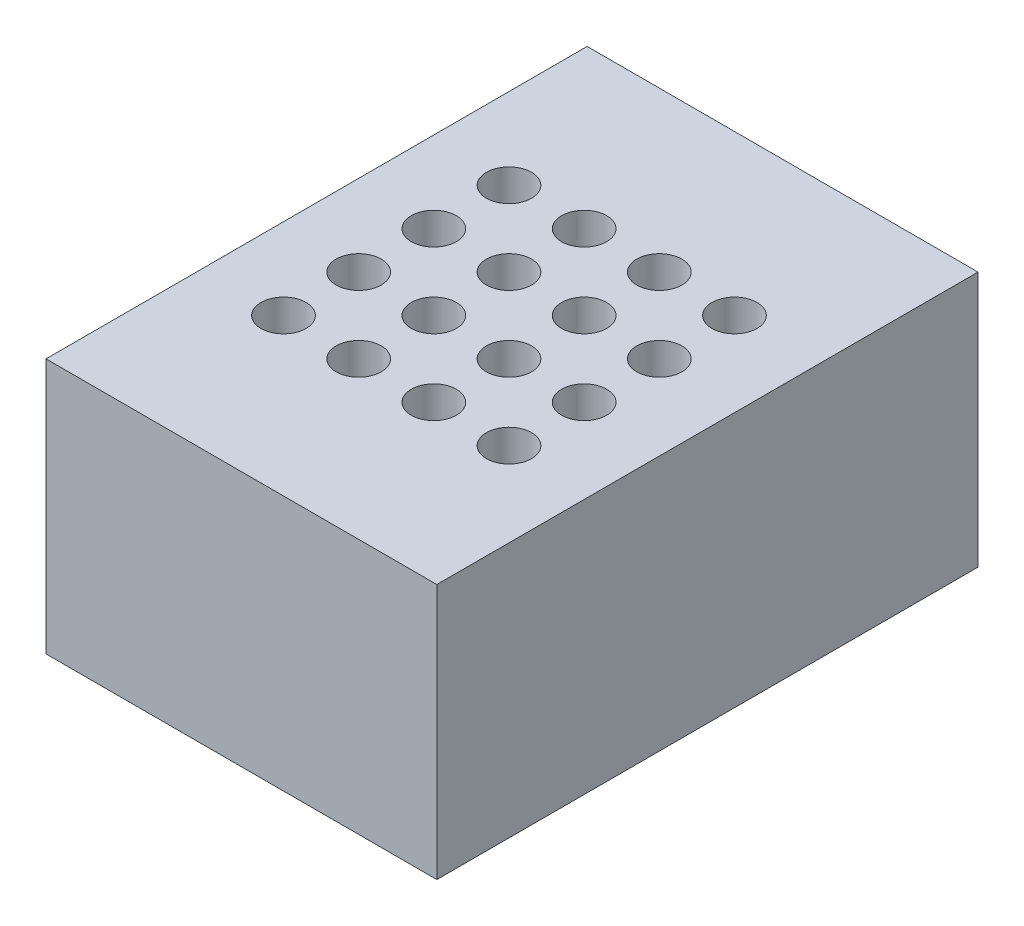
SolidWorks part; units mm, degrees
ref_plane "Front Plane" through (0, 0, 0) normal (0, 0, 1) x (1, 0, 0)
ref_plane "Top Plane" through (0, 0, 0) normal (0, 1, 0) x (1, 0, 0)
ref_plane "Right Plane" through (0, 0, 0) normal (1, 0, 0) x (0, 0, -1)
sketch "Sketch1" plane through (0, 0, 0) normal (0, 1, 0) x (1, 0, 0)
  line L1 (-5.835, -12.3052) -> (7.165, -12.3052)
  line L2 (-5.835, -12.3052) -> (-5.835, 5.6948)
  line L3 (-5.835, 5.6948) -> (7.165, 5.6948)
  line L4 (7.165, -12.3052) -> (7.165, 5.6948)
  dimension "D1" = 13
  dimension "D2" = 18
extrude "Boss-Extrude1" add sketch "Sketch1" along normal blind 8.5
sketch "Sketch2" plane through (0, 8.5, 0) normal (0, 1, 0) x (1, 0, 0)
  line L0 (7.165, 5.6948) -> (-5.835, 5.6948) construction
  line L4 (7.165, -12.3052) -> (7.165, 5.6948) construction
  circle A0 centre (4.365, 0.3948) radius 0.75
  circle A1 centre (1.865, 0.3948) radius 0.75
  circle A2 centre (-0.635, 0.3948) radius 0.75
  circle A3 centre (-3.135, 0.3948) radius 0.75
  circle A4 centre (1.865, -2.1052) radius 0.75
  circle A5 centre (-0.635, -2.1052) radius 0.75
  circle A6 centre (-3.135, -2.1052) radius 0.75
  circle A7 centre (1.865, -4.6052) radius 0.75
  circle A8 centre (-0.635, -4.6052) radius 0.75
  circle A9 centre (-3.135, -4.6052) radius 0.75
  circle A10 centre (1.865, -7.1052) radius 0.75
  circle A11 centre (-0.635, -7.1052) radius 0.75
  circle A12 centre (-3.135, -7.1052) radius 0.75
  circle A13 centre (4.365, -2.1052) radius 0.75
  circle A14 centre (4.365, -4.6052) radius 0.75
  circle A15 centre (4.365, -7.1052) radius 0.75
  dimension "D1" = 5.3
  dimension "D3" = 1.5
  dimension "D2" = 2.8
  dimension "D4" = 4
  dimension "D5" = 4
extrude "Cut-Extrude1" cut sketch "Sketch2" against normal blind 7
sketch "Sketch3" plane through (0, 0, 0) normal (0, -1, 0) x (1, 0, 0)
  line L1 (-4.1206, 10.4552) -> (5.4506, 10.4552)
  line L2 (-4.1206, 10.4552) -> (-4.1206, 9.3959)
  line L3 (-4.1206, 9.3959) -> (5.4506, 9.3959)
  line L4 (5.4506, 10.4552) -> (5.4506, 9.3959)
  line L5 (-4.1206, -4.4501) -> (5.4506, -4.4501)
  line L6 (-4.1206, -4.4501) -> (-4.1206, -3.2395)
  line L7 (-4.1206, -3.2395) -> (5.4506, -3.2395)
  line L8 (5.4506, -4.4501) -> (5.4506, -3.2395)
extrude "Cut-Extrude2" cut sketch "Sketch3" against normal blind 1.5
